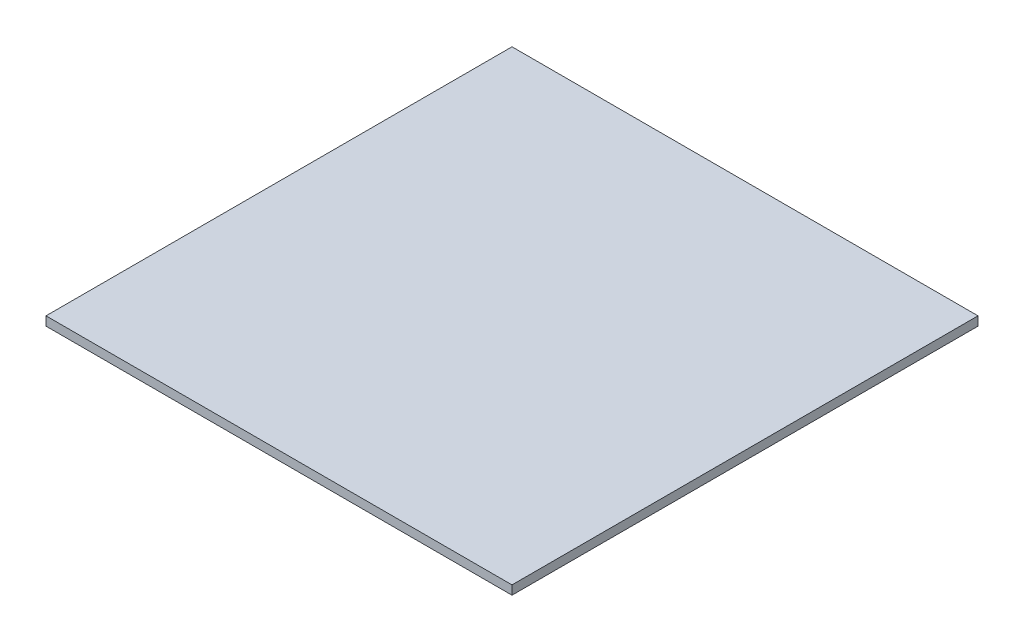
SolidWorks part; units mm, degrees
ref_plane "Front" through (0, 0, 0) normal (0, 0, 1) x (1, 0, 0)
ref_plane "Top" through (0, 0, 0) normal (0, 1, 0) x (1, 0, 0)
ref_plane "Right" through (0, 0, 0) normal (1, 0, 0) x (0, 0, -1)
sketch "Sketch1" plane through (0, 0, 0) normal (0, 1, 0) x (1, 0, 0)
  line L1 (165.1, -165.1) -> (-165.1, -165.1)
  line L2 (165.1, -165.1) -> (165.1, 165.1)
  line L3 (165.1, 165.1) -> (-165.1, 165.1)
  line L4 (-165.1, -165.1) -> (-165.1, 165.1)
  line L5 (165.1, -165.1) -> (-165.1, 165.1) construction
  line L6 (165.1, 165.1) -> (-165.1, -165.1) construction
  point P0 (0, 0)
  dimension "D1" = 330.2
  dimension "D2" = 330.2
extrude "Boss-Extrude1" add sketch "Sketch1" along normal blind 6.35 contours L4 L3 L2 L1
